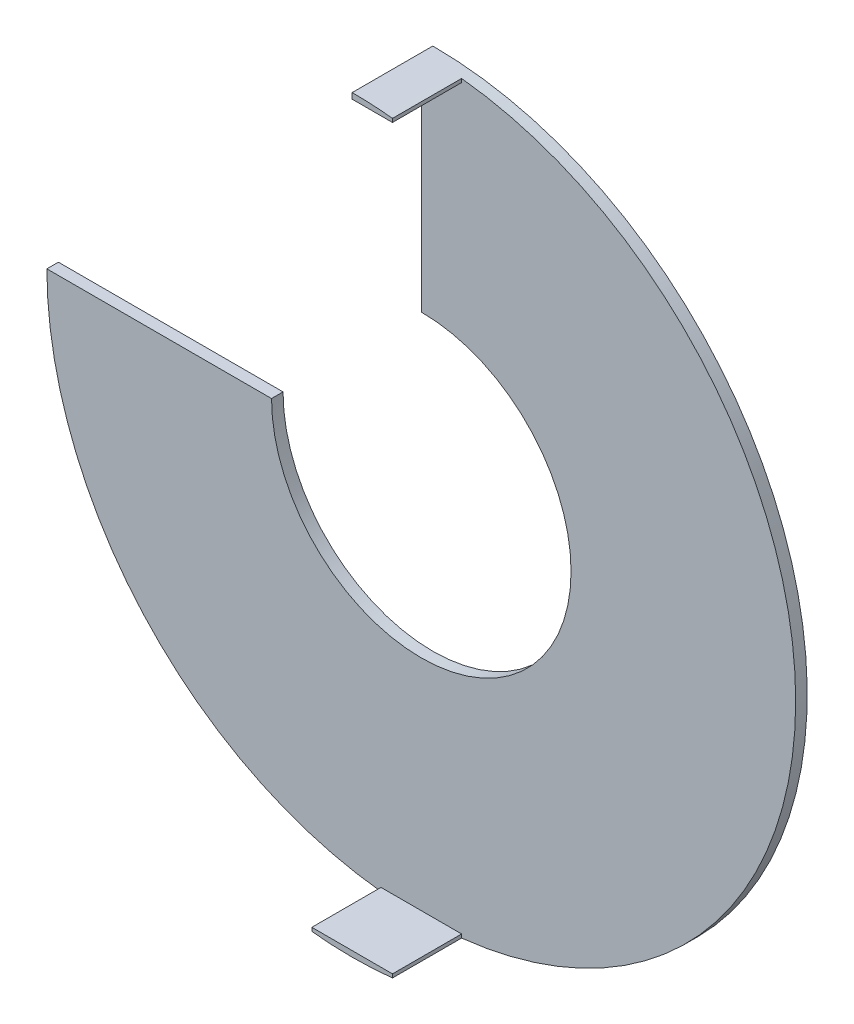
SolidWorks part; units mm, degrees
ref_plane "Plan de face" through (0, 0, 0) normal (0, 0, 1) x (1, 0, 0)
ref_plane "Plan de dessus" through (0, 0, 0) normal (0, 1, 0) x (1, 0, 0)
ref_plane "Plan de droite" through (0, 0, 0) normal (1, 0, 0) x (0, 0, -1)
sketch "Esquisse1" plane through (0, 0, 0) normal (0, 0, 1) x (1, 0, 0)
  circle A0 centre (0, 0) radius 16.25
  circle A1 centre (0, 0) radius 6.5
  dimension "D1" = 32.5
  dimension "D2" = 13
extrude "Extrusion1" add sketch "Esquisse1" along normal blind 0.5
sketch "Esquisse2" plane through (0, 0, 0.5) normal (0, 0, 1) x (1, 0, 0)
  line L0 (0, 0) -> (0, 17.6601) construction
  line L1 (-12.0424, 16.25) -> (14.9599, 16.25) construction
  line L3 (-1.75, 16.1555) -> (-1.75, 16)
  line L4 (-1.75, 16) -> (1.75, 16)
  line L5 (1.75, 16.1555) -> (1.75, 16)
  circle A0 centre (0, 0) radius 16.25 construction
  arc A1 (1.75, 16.1555) -> (-1.75, 16.1555) centre (0, 0) ccw
  dimension "D1" = 3.5
  dimension "D2" = 1.75
  dimension "D3" = 0.25
extrude "Extrusion2" add sketch "Esquisse2" along normal blind 3
pattern_circular "Répétition circulaire1" count 2 over 360 about axis through (0, 0, 0) along (0, 0, 1) of "Extrusion2"
sketch "Esquisse3" plane through (0, 0, 0) normal (1, 0, 0) x (0, 0, -1)
  line L1 (-11.727, 0) -> (10.1961, 0)
  line L2 (-11.727, 0) -> (-11.727, 17.1255)
  line L3 (-11.727, 17.1255) -> (10.1961, 17.1255)
  line L4 (10.1961, 0) -> (10.1961, 17.1255)
extrude "Enlèv. mat.-Extru.1" cut sketch "Esquisse3" against normal through all
